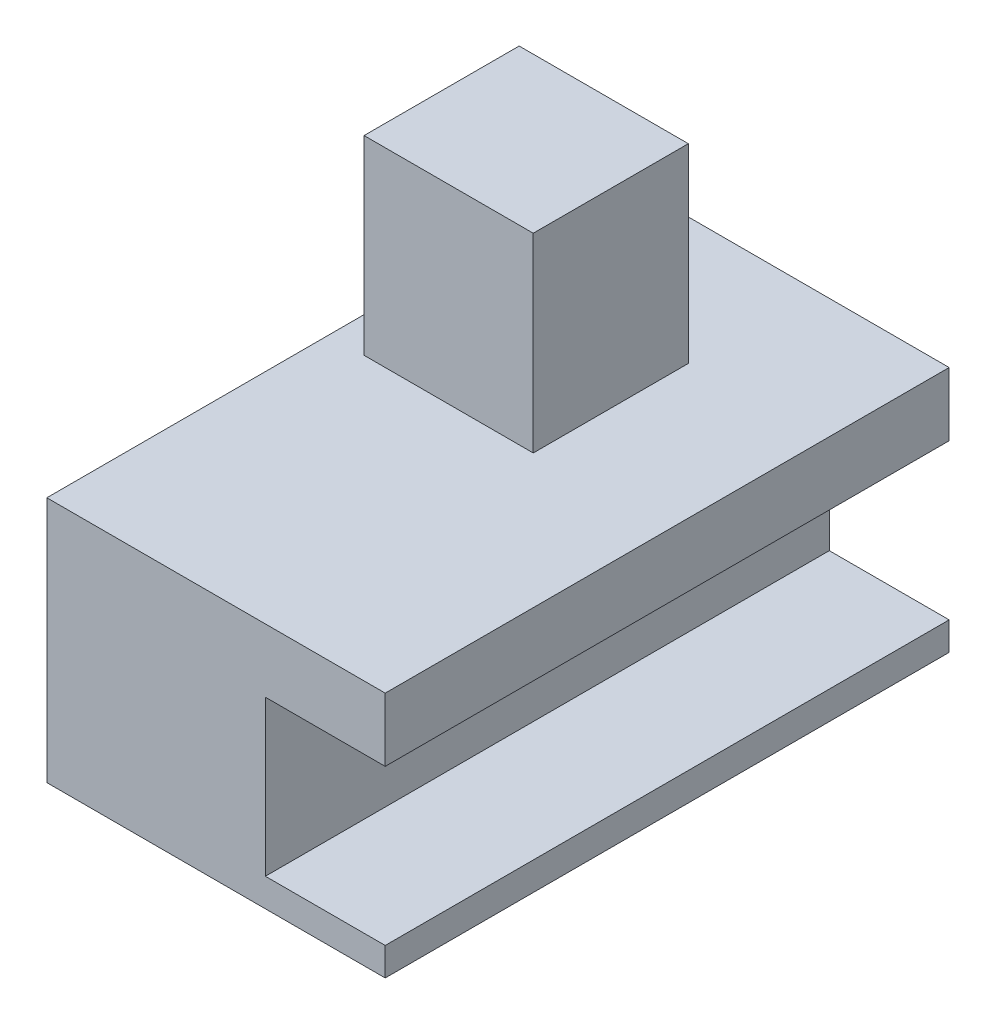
SolidWorks part; units mm, degrees
ref_plane "Face" through (0, 0, 0) normal (0, 0, 1) x (1, 0, 0)
ref_plane "Dessus" through (0, 0, 0) normal (0, 1, 0) x (1, 0, 0)
ref_plane "Droite" through (0, 0, 0) normal (1, 0, 0) x (0, 0, -1)
sketch "Esquisse1" plane through (0, 0, 0) normal (0, 0, 1) x (1, 0, 0)
  line L0 (48, 26) -> (31, 26)
  line L1 (0, 0) -> (48, 0)
  line L2 (0, 0) -> (0, 35)
  line L3 (0, 35) -> (48, 35)
  line L4 (48, 0) -> (48, 4)
  line L5 (31, 26) -> (31, 4)
  line L6 (31, 4) -> (48, 4)
  line L7 (48, 26) -> (48, 35)
  dimension "D1" = 48
  dimension "D2" = 31
  dimension "D3" = 4
  dimension "D4" = 35
  dimension "D5" = 22
extrude "Extrusion1" add sketch "Esquisse1" against normal blind 80
sketch "Esquisse2" plane through (0, 35, 0) normal (0, 1, 0) x (-1, 0, 0)
  line L0 (0, -80) -> (0, 0) construction
  line L1 (-29, -62) -> (-5, -62)
  line L2 (-29, -62) -> (-29, -40)
  line L3 (-29, -40) -> (-5, -40)
  line L4 (-5, -62) -> (-5, -40)
  line L5 (-48, 0) -> (0, 0) construction
  dimension "D1" = 22
  dimension "D2" = 24
  dimension "D3" = 5
  dimension "D4" = 40
extrude "Extrusion2" add sketch "Esquisse2" along normal blind 27
